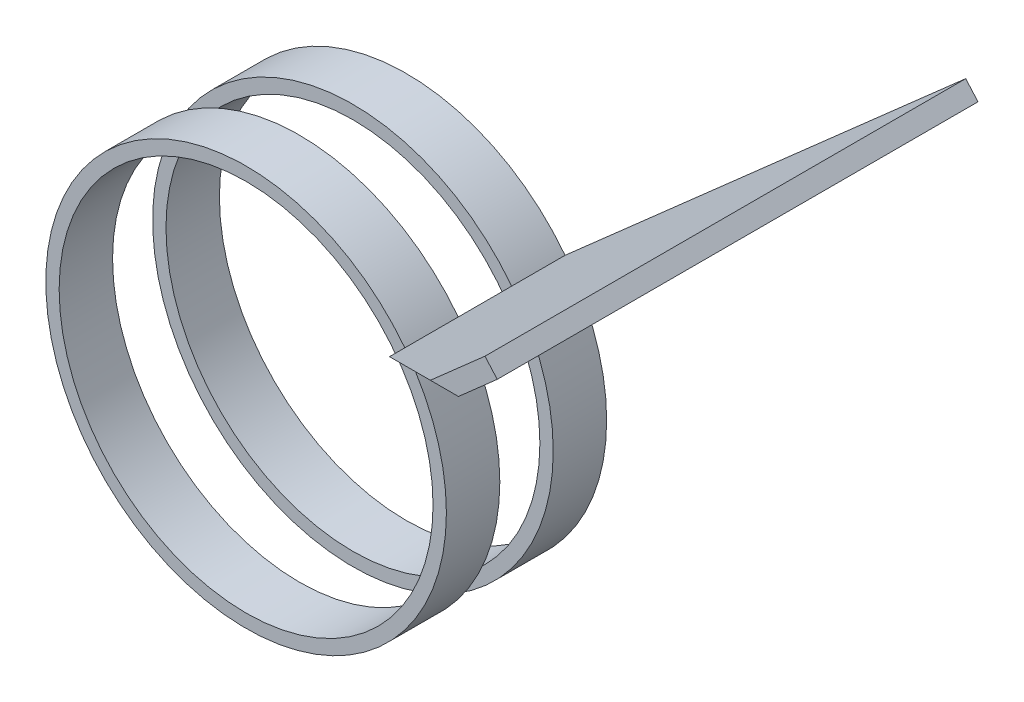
SolidWorks part; units mm, degrees
ref_plane "Front Plane" through (0, 0, 0) normal (0, 0, 1) x (1, 0, 0)
ref_plane "Top Plane" through (0, 0, 0) normal (0, 1, 0) x (1, 0, 0)
ref_plane "Right Plane" through (0, 0, 0) normal (1, 0, 0) x (0, 0, -1)
sketch "Sketch1" plane through (0, 0, 0) normal (0, 0, 1) x (1, 0, 0)
  circle A0 centre (0, 0) radius 37.5
  dimension "D1" = 75
extrude "Boss-Extrude1" add sketch "Sketch1" along normal blind 10
sketch "Sketch2" plane through (0, 0, 10) normal (0, 0, 1) x (1, 0, 0)
  circle A0 centre (0, 0) radius 35
  dimension "D1" = 70
extrude "Cut-Extrude1" cut sketch "Sketch2" against normal blind 10
sketch "Sketch5" plane through (0, 0, 10) normal (0, 0, 1) x (1, 0, 0)
  line L0 (29.7186, 22.8703) -> (104.7186, 89.0141)
  line L1 (104.7186, 89.0141) -> (107.0188, 86.406)
  line L2 (107.0188, 86.406) -> (31.7214, 20)
  line L3 (31.7214, 20) -> (29.7186, 22.8703)
  circle A0 centre (0, 0) radius 37.5 construction
  dimension "D1" = 100
  dimension "D2" = 3.5
  dimension "D3" = 75
  dimension "D4" = 20
extrude "Boss-Extrude2" add sketch "Sketch5" against normal mid plane 120
ref_plane "Plane1" through (107.0188, 0, 0) normal (1, 0, 0) x (0, 0, -1)
sketch "Sketch6" plane through (107.0188, 0, 0) normal (1, 0, 0) x (0, 0, -1)
  line L0 (-10, 20) -> (-70, 80)
  line L2 (-70, 80) -> (-70, 20)
  line L3 (-70, 20) -> (-10, 20)
  line L4 (-70, 20) -> (-70, 86.406) construction
  dimension "D1" = 60
extrude "Cut-Extrude2" cut sketch "Sketch6" against normal blind 100
sketch "Sketch7" plane through (107.0188, 0, 0) normal (1, 0, 0) x (0, 0, -1)
  line L0 (50, 20) -> (0, 20) construction
  line L3 (-10, 20) -> (20, 20) construction
  line L5 (20, 20) -> (50, 20)
  line L6 (20, 20) -> (20, 95)
  line L7 (20, 95) -> (50, 95)
  line L8 (50, 20) -> (50, 95)
  dimension "D1" = 30
  dimension "D2" = 75
  dimension "D3" = 30
extrude "Cut-Extrude3" cut sketch "Sketch7" against normal blind 100
ref_plane "Plane2" through (0, 0, -10) normal (0, 0, 1) x (1, 0, 0)
sketch "Sketch8" plane through (0, 0, -10) normal (0, 0, 1) x (1, 0, 0)
  circle A0 centre (0, 0) radius 37.5
  dimension "D1" = 75
extrude "Boss-Extrude3" add sketch "Sketch8" against normal blind 10
sketch "Sketch9" plane through (0, 0, -20) normal (0, 0, -1) x (-1, 0, 0)
  circle A0 centre (0, 0) radius 35
  dimension "D1" = 70
sketch "Sketch10" plane through (0, 0, 10) normal (0, 0, 1) x (1, 0, 0)
  circle A0 centre (0, 0) radius 37.5
  dimension "D1" = 75
sketch "Sketch11" plane through (0, 0, -10) normal (0, 0, 1) x (1, 0, 0)
  circle A0 centre (0, 0) radius 35
  dimension "D1" = 70
extrude "Cut-Extrude5" cut sketch "Sketch11" against normal through all
